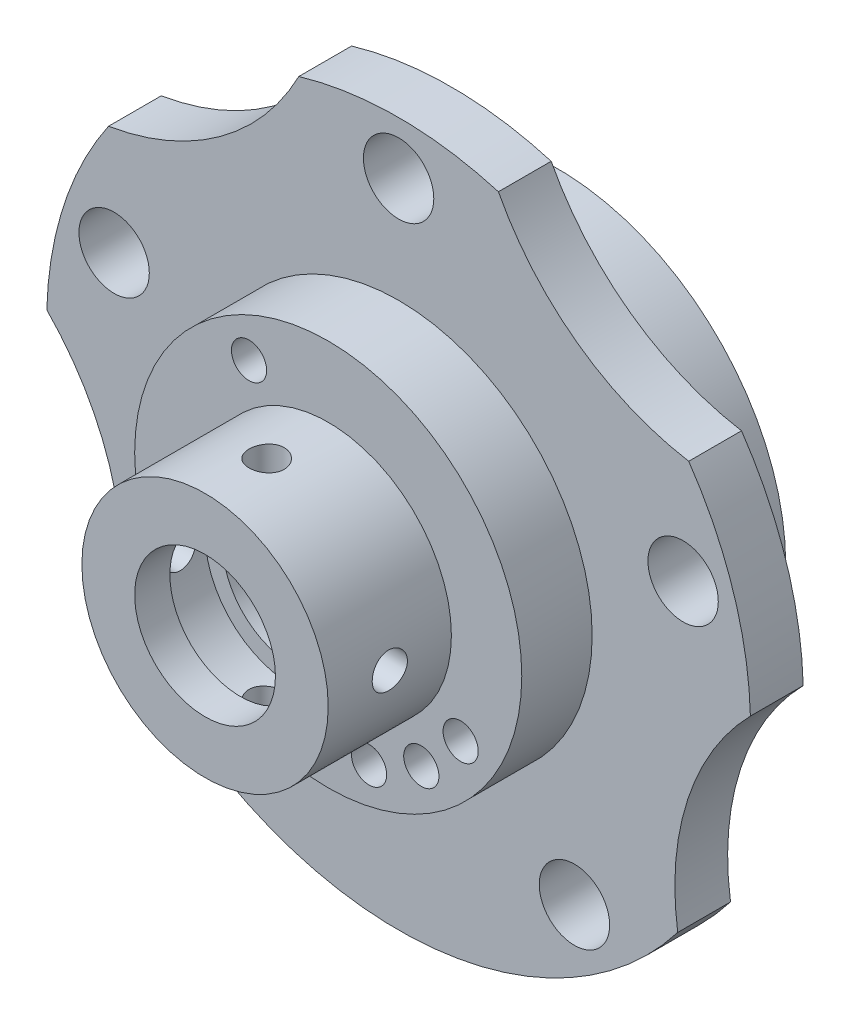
SolidWorks part; units mm, degrees
ref_plane "前视基准面" through (0, 0, 0) normal (0, 0, 1) x (1, 0, 0)
ref_plane "上视基准面" through (0, 0, 0) normal (0, 1, 0) x (1, 0, 0)
ref_plane "右视基准面" through (0, 0, 0) normal (1, 0, 0) x (0, 0, -1)
sketch "草图1" plane through (0, 0, 0) normal (0, 0, 1) x (1, 0, 0)
  line L0 (0, 0) -> (0, 32.165) construction
  line L1 (0, 0) -> (34.7191, 11.2809) construction
  line L2 (0, 0) -> (20.8139, -28.6479) construction
  line L3 (0, 0) -> (-18.9628, -26.1) construction
  line L4 (0, 0) -> (-36.3256, 11.8029) construction
  line L5 (0, 0) -> (25.5974, 35.2319) construction
  line L6 (0, 0) -> (44.8155, -14.5615) construction
  line L7 (0, 0) -> (-22.379, 30.8021) construction
  line L8 (0, 0) -> (-35.4399, -11.5151) construction
  circle A0 centre (0, 0) radius 5
  arc A1 (19.9929, 0.532) -> (16.4873, 11.3211) centre (0, 0) ccw
  circle A3 centre (16.168, 5.2533) radius 2
  circle A4 centre (9.9923, -13.7533) radius 2
  circle A5 centre (-9.9923, -13.7533) radius 2
  circle A6 centre (-16.168, 5.2533) radius 2
  circle A7 centre (0, 17) radius 2
  arc A8 (5.6722, 19.1788) -> (16.4873, 11.3211) centre (18.9728, 26.1138) ccw
  arc A10 (-16.4873, 11.3211) -> (-5.6722, 19.1788) centre (-18.9728, 26.1138) ccw
  arc A11 (19.9929, 0.532) -> (15.8619, -12.1819) centre (30.6986, -9.9746) ccw
  arc A12 (-15.8619, -12.1819) -> (-19.9929, 0.532) centre (-30.6986, -9.9746) ccw
  arc A13 (-16.4873, 11.3211) -> (-19.9929, 0.532) centre (0, 0) ccw
  arc A14 (5.6722, 19.1788) -> (-5.6722, 19.1788) centre (0, 0) ccw
  arc A15 (-15.8619, -12.1819) -> (15.8619, -12.1819) centre (0, 0) ccw
extrude "拉伸1" add sketch "草图1" along normal blind 3
sketch "草图2" plane through (0, 0, 3) normal (0, 0, 1) x (1, 0, 0)
  circle A0 centre (0, 0) radius 11
  circle A1 centre (0, 0) radius 5
extrude "拉伸2" add sketch "草图2" along normal blind 4
sketch "草图3" plane through (0, 0, 7) normal (0, 0, 1) x (1, 0, 0)
  circle A0 centre (0, 0) radius 7
  circle A1 centre (0, 0) radius 4
extrude "拉伸3" add sketch "草图3" along normal blind 7
sketch "草图4" plane through (0, 0, 0) normal (0, 1, 0) x (1, 0, 0)
  line L0 (-7, -14) -> (7, -14) construction
  line L1 (-5, -9) -> (0, -9)
  line L2 (-5, -9) -> (-5, -12)
  line L3 (-5, -12) -> (0, -12)
  line L4 (0, -9) -> (0, -12)
  line L5 (0, 0) -> (0, -15.6176) construction
  dimension "D1" = 2
  dimension "D2" = 3
  dimension "D3" = 5
revolve "切除-旋转1" cut sketch "草图4" angle 360 about L5
sketch "草图5" plane through (0, 0, 7) normal (0, 0, 1) x (1, 0, 0)
  line L0 (0, 0) -> (-11.5102, 19.9363) construction
  line L1 (0, 0) -> (0, 22.3124) construction
  line L2 (0, 0) -> (9.9923, -13.7533) construction
  line L3 (0, 0) -> (4.5387, -16.9387) construction
  line L4 (0, 0) -> (13.9093, -9.0328) construction
  circle A0 centre (-4.5, 7.7942) radius 1
  circle A2 centre (5.2901, -7.2812) radius 1
  circle A3 centre (2.3212, -8.6955) radius 1
  circle A4 centre (7.5259, -4.9357) radius 1
  dimension "D2" = 21
  dimension "D1" = 30
  dimension "D3" = 21
extrude "切除-拉伸1" cut sketch "草图5" against normal through all
sketch "草图6" plane through (0, 0, 0) normal (0, 0, -1) x (-1, 0, 0)
  circle A0 centre (0, 0) radius 11
  circle A1 centre (0, 0) radius 13
extrude "拉伸4" add sketch "草图6" along normal blind 6
sketch "草图7" plane through (0, 0, 0) normal (1, 0, 0) x (0, 0, -1)
  line L0 (0, 0) -> (-22.9242, 0) construction
  line L1 (-14, 7) -> (-14, -7) construction
  circle A0 centre (-10.5, 0) radius 1
  dimension "D1" = 3.5
extrude "切除-拉伸2" cut sketch "草图7" against normal mid plane 20
sketch "草图8" plane through (0, 0, 0) normal (0, 1, 0) x (1, 0, 0)
  line L0 (0, 0) -> (0, -20.3416) construction
  line L1 (-7, -14) -> (7, -14) construction
  circle A0 centre (0, -10.5) radius 1
  dimension "D1" = 3.5
extrude "切除-拉伸3" cut sketch "草图8" against normal mid plane 20
